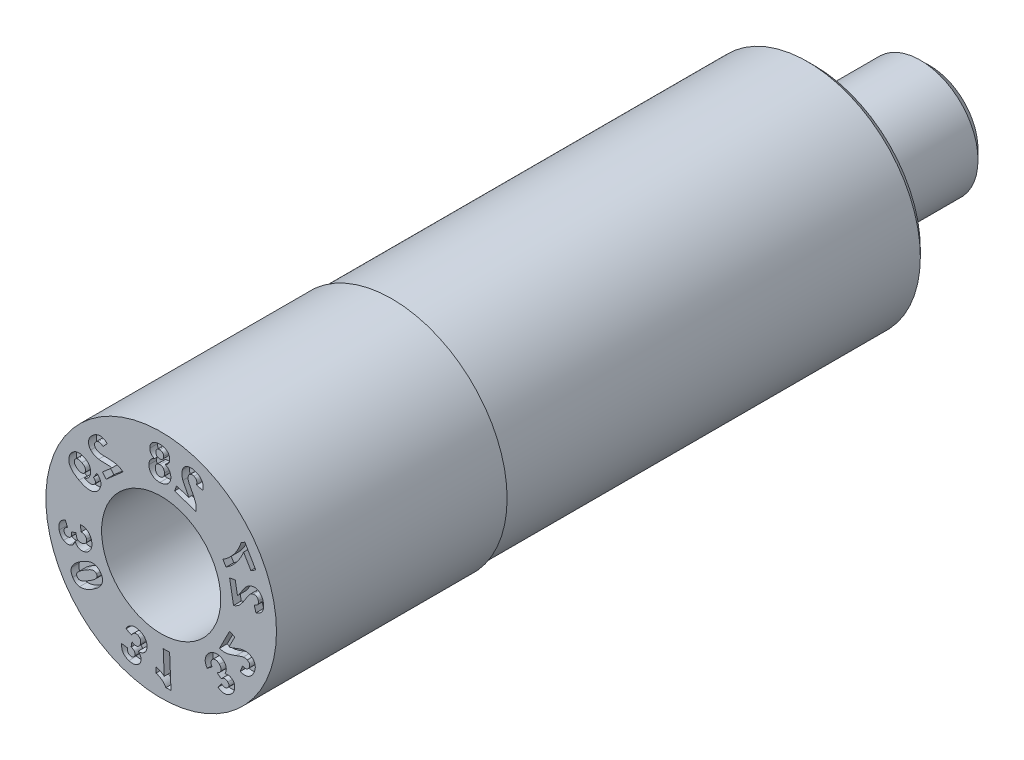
SolidWorks part; units mm, degrees
other "<M3 X .5 SHSS>-<Revolve1>"
ref_plane "Front Plane" through (0, 0, 0) normal (0, 0, 1) x (1, 0, 0)
ref_plane "Top Plane" through (0, 0, 0) normal (0, 1, 0) x (1, 0, 0)
ref_plane "Right Plane" through (0, 0, 0) normal (1, 0, 0) x (0, 0, -1)
sketch "Sketch1" plane through (0, 0, 0) normal (1, 0, 0) x (0, 0, -1)
  line L2 (0, 3) -> (0, 1.55)
  line L3 (16.75, 3) -> (0, 3)
  line L4 (-3.7979, 0) -> (49996.2021, 0) construction
  line L8 (14, 0.8) -> (2.8, 0.8)
  line L9 (2.8, 1.55) -> (2.8, 0.8)
  line L10 (2.8, 1.55) -> (0, 1.55)
  line L12 (17, 1.5) -> (17, 2.75)
  line L16 (17, 2.75) -> (16.75, 3)
  line L17 (17, 1.5) -> (14, 1.5)
  line L18 (14, 0.8) -> (14, 1.5)
  dimension "D1" = 17
  dimension "D2" = 45
  dimension "D3" = 0.25
  dimension "D4" = 6
  dimension "D5" = 3.1
  dimension "D6" = 2.8
  dimension "D7" = 1.6
  dimension "D8" = 3
  dimension "D9" = 3
revolve "Revolve1" add sketch "Sketch1" angle 360 about L4
sketch "Sketch4" plane through (0, 0, 0) normal (1, 0, 0) x (0, 0, -1)
  line L0 (0, 0) -> (50000, 0) construction
  line L1 (17, -2.75) -> (17, 2.75) construction
  line L2 (6, 3.935) -> (17, 3.935)
  line L3 (6, 3.935) -> (6, 2.935)
  line L4 (6, 2.935) -> (17, 2.935)
  line L5 (17, 3.935) -> (17, 2.935)
  line L6 (16.75, 3) -> (0, 3) construction
  line L9 (0, 3.3) -> (0, -3.3) construction
  dimension "D1" = 1
  dimension "D2" = 0.065
  dimension "D3" = 6
revolve "Cut-Revolve1" cut sketch "Sketch4" angle 360 about L0
sketch "Sketch2" plane through (0, 0, 0) normal (0, 0, 1) x (1, 0, 0)
  line L0 (0, 0) -> (0, 3.6959) construction
  line L1 (0, 0) -> (3.2008, 1.848) construction
  line L2 (0, 0) -> (3.2008, -1.848) construction
  line L3 (0, 0) -> (0, -3.6959) construction
  line L4 (0, 0) -> (-3.2008, -1.848) construction
  line L5 (0, 0) -> (-3.2008, 1.848) construction
  circle A0 centre (0, 0) radius 1.8893 construction
  text T0 "27  28  29  30  31  32" font "Arial" height 0.85
  point P10 (0, 0)
  point P849 (0, 0.0048)
  point P850 (0.0048, 0.0048)
  point P851 (0.0048, 0)
  dimension "D1" = 6
extrude "Cut-Extrude1" cut sketch "Sketch2" against normal blind 0.2
sketch "Sketch3" plane through (0, 0, -2.8) normal (0, 0, 1) x (1, 0, 0)
  line L0 (0, 0) -> (0, 50000) construction
  line L1 (0.4619, 0.8) -> (-0.4619, 0.8)
  line L2 (-0.4619, 0.8) -> (-0.9238, 0)
  line L3 (-0.9238, 0) -> (-0.4619, -0.8)
  line L4 (-0.4619, -0.8) -> (0.4619, -0.8)
  line L5 (0.4619, -0.8) -> (0.9238, 0)
  line L6 (0.9238, 0) -> (0.4619, 0.8)
  line L7 (0, 0) -> (50000, 0) construction
  circle A0 centre (0, 0) radius 0.8 construction
  circle A1 centre (0, 0) radius 0.8 construction
extrude "Cut-Extrude2" cut sketch "Sketch3" against normal blind 1.4
inserted part "M3 X .5 SHSS"
move or copy body "Body-Move/Copy2" placed by mates yes
